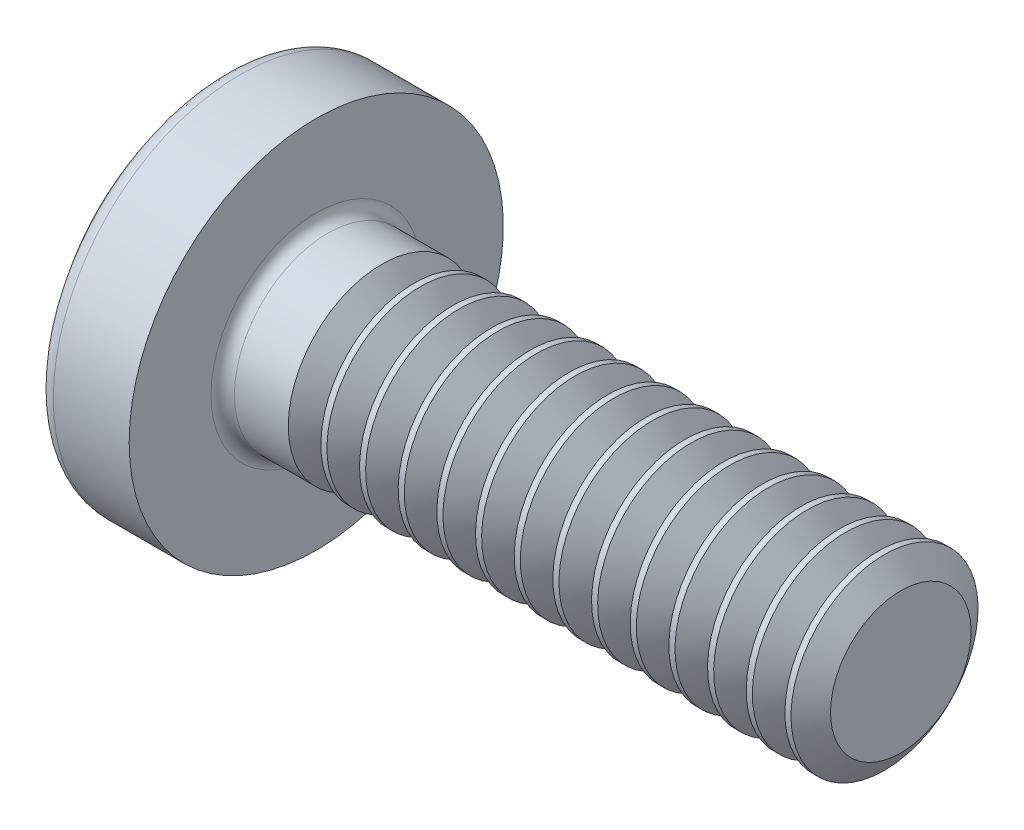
SolidWorks part; units mm, degrees
ref_plane "Plane1" through (0, 0, 0) normal (0, 0, 1) x (1, 0, 0)
ref_plane "Plane2" through (0, 0, 0) normal (0, 1, 0) x (1, 0, 0)
ref_plane "Plane3" through (0, 0, 0) normal (1, 0, 0) x (0, 0, -1)
revolve "Base-Revolve" add sketch "BodySke"
sketch "BodySke" plane through (0, 0, 0) normal (0, 0, 1) x (1, 0, 0)
  line L0 (1.3, 0.8) -> (1.3, 1.6)
  line L1 (1.475, 6.35) -> (1.475, -3.175) construction
  line L2 (-25.4, 0) -> (127, 0) construction
  line L3 (6.3, 0) -> (0, 0)
  line L4 (1.3, 0.8) -> (6.3, 0.8)
  line L5 (6.3, 0.8) -> (6.3, 0)
  line L6 (0.6507, 1.6) -> (1.3, 1.6)
  line L8 (1.3, 6.35) -> (1.3, -3.175) construction
  arc A0 (0.5326, 1.5426) -> (0, 0) centre (2.5, 0) ccw
  arc A2 (0.5326, 1.5426) -> (0.6507, 1.6) centre (0.6507, 1.45) cw
  dimension "Head_fillet_rad" = 0.15
  dimension "Head_crown_rad" = 2.5
  dimension "Head_ht" = 1.3
  dimension "Diameter" = 1.6
  dimension "Length" = 5
  dimension "Head_dia" = 3.2
  dimension "Advance" = 0.35
  dimension "Thread_nom" = 5
fillet "Fillet1" radius 0.1
sketch "Sketch3" plane through (0, 0, 0) normal (1, 0, 0) x (0, 0, -1)
  line L0 (0.24, -0.8) -> (-0.24, -0.8)
  line L1 (0.24, -0.8) -> (0.24, 0.8)
  line L2 (-0.24, 0.8) -> (0.24, 0.8)
  line L3 (-0.24, 0.8) -> (-0.24, -0.8)
  dimension "D1" = 0.8
  dimension "Cross_dia" = 1.6
  dimension "D2" = 0.24
  dimension "Cross_width" = 0.48
ref_plane "Plane4" through (0.9, 0, 0) normal (1, 0, 0) x (0, 0, -1)
sketch "Sketch4" plane through (0.9, 0, 0) normal (1, 0, 0) x (0, 0, -1)
  line L0 (0.24, -0.3513) -> (-0.24, -0.3513)
  line L1 (0.24, -0.3513) -> (0.24, 0.3513)
  line L2 (-0.24, 0.3513) -> (0.24, 0.3513)
  line L3 (-0.24, 0.3513) -> (-0.24, -0.3513)
  dimension "D1" = 0.48
  dimension "D2" = 0.7026
  dimension "D3" = 0.24
  dimension "D4" = 0.3513
loft "Recess" cut profiles "Sketch3", "Sketch4"
pattern_circular "RecPat" count 2 every 90
sketch "RecCorSke" plane through (0, 0, 0) normal (0, 0, 1) x (1, 0, 0)
  line L0 (-3.175, 0) -> (15.875, 0) construction
  line L1 (-25.4, 0) -> (127, 0) construction
  line L2 (0, 0) -> (0, 0.4184)
  line L3 (0, 0.4184) -> (0.9, 0.3555)
  line L4 (0.9, 0.3555) -> (1.0155, 0)
  line L5 (1.0155, 0) -> (0, 0)
  dimension "Diameter" = 0.711
  dimension "Depth" = 0.9
  dimension "Draft_angle" = 4
  dimension "Bottom_angle" = 18
revolve "RecessCore" cut sketch "RecCorSke" angle 360 about L0
sketch "ThdSchSke" plane through (0, 0, 0) normal (0, 0, 1) x (1, 0, 0)
  line L0 (2, -0.601) -> (1.8607, -0.8)
  line L1 (2, -0.601) -> (2.1393, -0.8)
  line L2 (2.1393, -0.8) -> (2.1393, -1)
  line L3 (-3.175, 0) -> (5.1513, 0) construction
  line L5 (2.1393, -1) -> (1.8607, -1)
  line L6 (1.8607, -1) -> (1.8607, -0.8)
  dimension "Thread_minor" = 1.202
  dimension "Diameter" = 1.6
  dimension "Start" = 2
  dimension "SideAngle" = 55
  dimension "VeeAngle" = 70
  dimension "Overcut" = 2
revolve "ThreadSchematic" cut sketch "ThdSchSke" angle 360 about L3
pattern_linear "ThdSchPat"
equation "\"D1@Sketch3\" = \"Cross_dia@Sketch3\" / 2"
equation "\"D2@Sketch3\" = \"Cross_width@Sketch3\" / 2"
equation "\"Depth@RecCorSke\" = \"Cross_depth@Plane4\""
equation "\"D1@Sketch4\" = \"Cross_width@Sketch3\""
equation "\"D2@Sketch4\" = \"Cross_dia@Sketch3\" - 2.0 * \"Cross_depth@Plane4\" * tan(26.5  * 0.017453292)"
equation "\"D3@Sketch4\" = \"D1@Sketch4\" / 2"
equation "\"D4@Sketch4\" = \"D2@Sketch4\" / 2"
equation "\"Thread_length@ThreadCosmetic\" = ((sgn( (\"Length@BodySke\" - \"Advance@BodySke\" * 2.0 ) - \"Thread_nom@BodySke\" )-1)*( (\"Length@BodySke\" - \"Advance@BodySke\" * 2.0 ) - \"Thread_nom@BodySke\" ))/-2+ \"Thread_"
equation "\"Thread_minor@ThdSchSke\" = \"Thread_minor@ThreadCosmetic\""
equation "\"Diameter@ThdSchSke\" = \"Diameter@BodySke\""
equation "\"Overcut@ThdSchSke\" = \"Diameter@BodySke\" * 1.25"
equation "\"Start@ThdSchSke\" = \"Head_ht@BodySke\" + \"Length@BodySke\" - \"Thread_length@ThreadCosmetic\"  '---Non-countersunk---"
equation "\"Num_threads@ThdSchPat\" = int( \"Thread_length@ThreadCosmetic\" / \"Advance@BodySke\" + 0.999 )  + 1"
equation "\"Advance@ThdSchPat\" = \"Thread_length@ThreadCosmetic\" /  (\"Num_threads@ThdSchPat\" - 1) 'relax it"
